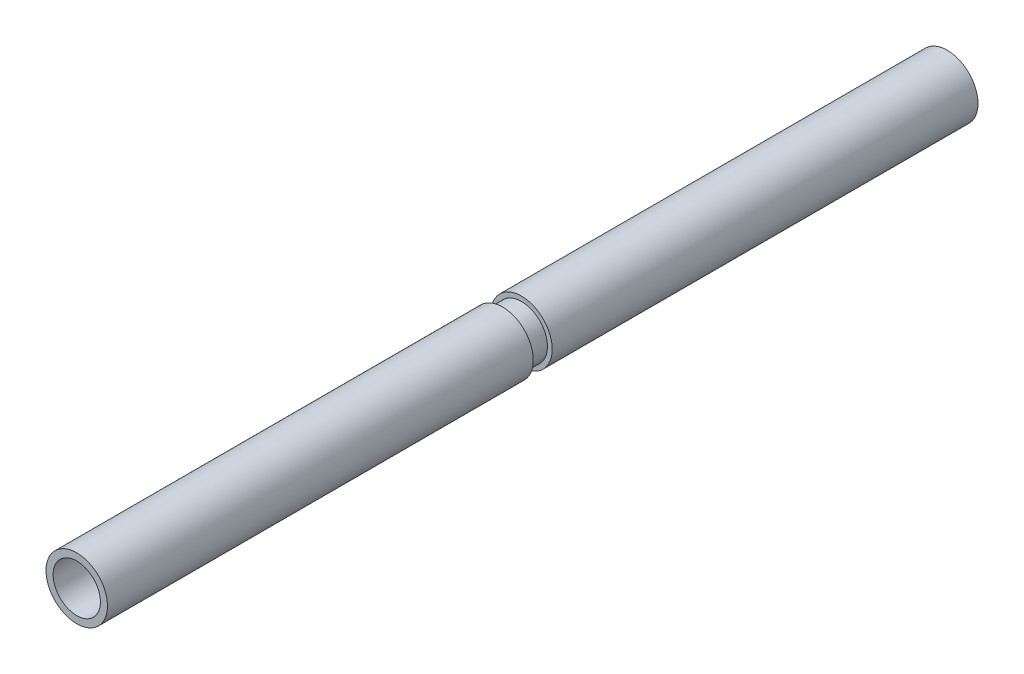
SolidWorks part; units mm, degrees
ref_plane "Front Plane" through (0, 0, 0) normal (0, 0, 1) x (1, 0, 0)
ref_plane "Top Plane" through (0, 0, 0) normal (0, 1, 0) x (1, 0, 0)
ref_plane "Right Plane" through (0, 0, 0) normal (1, 0, 0) x (0, 0, -1)
sketch "Sketch1" plane through (0, 0, 0) normal (0, 0, 1) x (1, 0, 0)
  circle A0 centre (0, 0) radius 6.5
  dimension "D1" = 13
extrude "Boss-Extrude1" add sketch "Sketch1" along normal blind 90
sketch "Sketch2" plane through (0, 0, 0) normal (0, 0, -1) x (-1, 0, 0)
  circle A0 centre (0, 0) radius 5.5
  dimension "D1" = 11
extrude "Boss-Extrude2" add sketch "Sketch2" along normal blind 4
sketch "Sketch3" plane through (0, 0, -4) normal (0, 0, -1) x (-1, 0, 0)
  circle A0 centre (0, 0) radius 6.5
  dimension "D1" = 13
extrude "Boss-Extrude3" add sketch "Sketch3" along normal blind 90
sketch "Sketch5" plane through (0, 0, -94) normal (0, 0, -1) x (-1, 0, 0)
  circle A0 centre (0, 0) radius 5
  dimension "D1" = 10
extrude "Cut-Extrude1" cut sketch "Sketch5" against normal blind 90
sketch "Sketch6" plane through (0, 0, 90) normal (0, 0, 1) x (1, 0, 0)
  circle A0 centre (0, 0) radius 5
  dimension "D1" = 10
extrude "Cut-Extrude2" cut sketch "Sketch6" against normal blind 90
sketch "Sketch7" plane through (0, 0, -4) normal (0, 0, -1) x (-1, 0, 0)
  circle A0 centre (0, 0) radius 5
  dimension "D1" = 10
extrude "Cut-Extrude3" cut sketch "Sketch7" against normal blind 90
